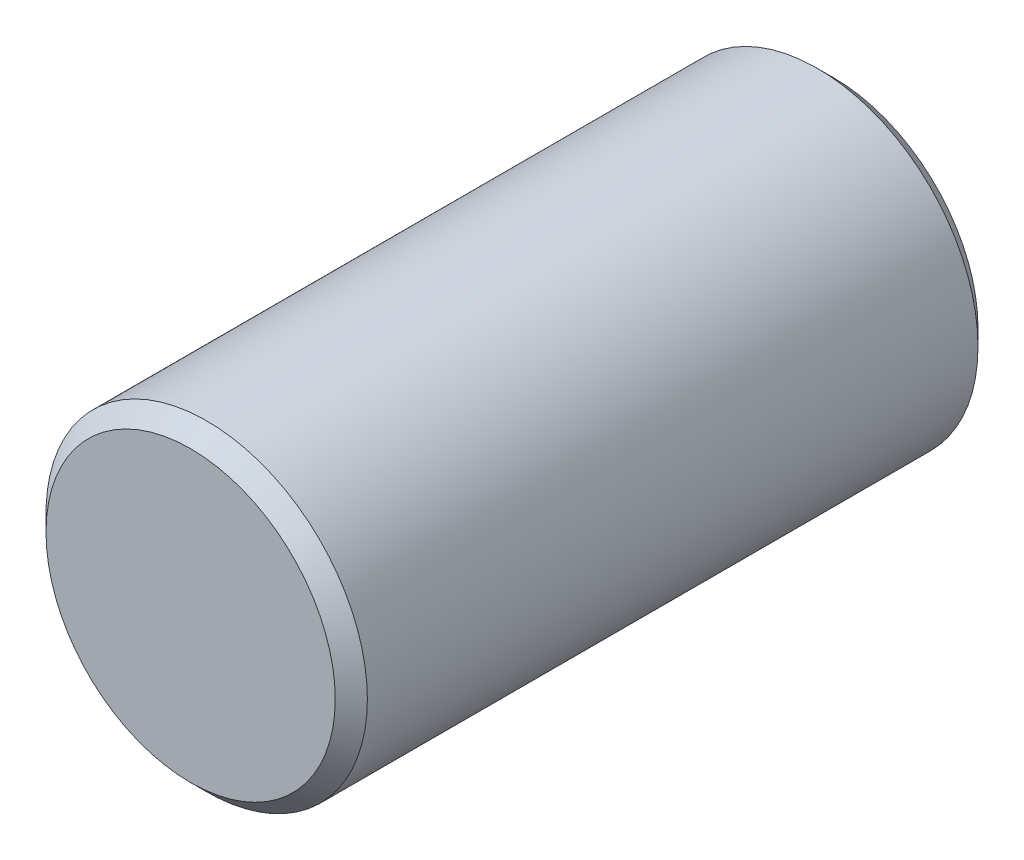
SolidWorks part; units mm, degrees
ref_plane "Ebene vorne" through (0, 0, 0) normal (0, 0, 1) x (1, 0, 0)
ref_plane "Ebene oben" through (0, 0, 0) normal (0, 1, 0) x (1, 0, 0)
ref_plane "Ebene rechts" through (0, 0, 0) normal (1, 0, 0) x (0, 0, -1)
sketch "Skizze1" plane through (0, 0, 0) normal (0, 0, 1) x (1, 0, 0)
  circle A0 centre (0, 0) radius 5
  dimension "D1" = 10
extrude "Linear austragen1" add sketch "Skizze1" along normal blind 20
chamfer "Fase1" distance 0.5 angle 45 2 edges at (5, 0, 0) (5, 0, 20)
ref_plane "Ebene1" through (0, 0, 11) normal (0, 0, 1) x (1, 0, 0)
sketch "Skizze2" plane through (0, 0, 11) normal (0, 0, 1) x (1, 0, 0)
  point P0 (0, 0)
equation "\"LÄNGE\"=0"
equation "\"BREITE\"=0"
equation "\"HÖHE\"=0"
equation "\"DURCHMESSER\"=0"
equation "\"Stückzahl\"= 1"
